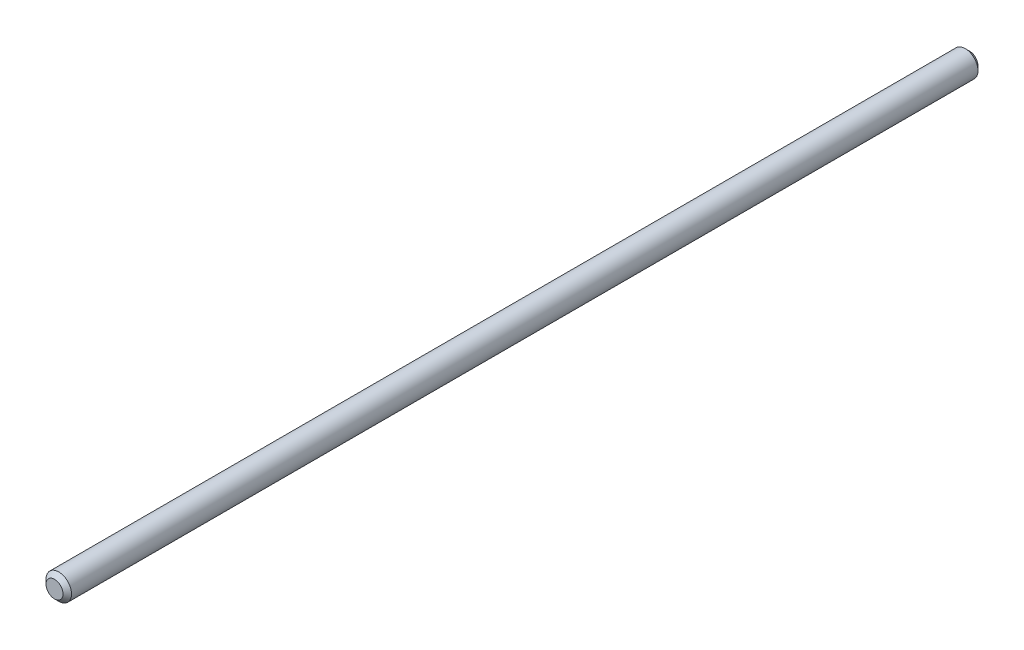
SolidWorks part; units mm, degrees
ref_plane "Plan de face" through (0, 0, 0) normal (0, 0, 1) x (1, 0, 0)
ref_plane "Plan de dessus" through (0, 0, 0) normal (0, 1, 0) x (1, 0, 0)
ref_plane "Plan de droite" through (0, 0, 0) normal (1, 0, 0) x (0, 0, -1)
sketch "Esquisse1" plane through (0, 0, 0) normal (0, 0, 1) x (1, 0, 0)
  circle A0 centre (0, 0) radius 3
  dimension "D1" = 6
extrude "Boss.-Extru.1" add sketch "Esquisse1" along normal blind 215
chamfer "Chanfrein1" distance 1 angle 45 1 edges at (3, 0, 215)
chamfer "Chanfrein2" distance 1 angle 45 1 edges at (3, 0, 0)
